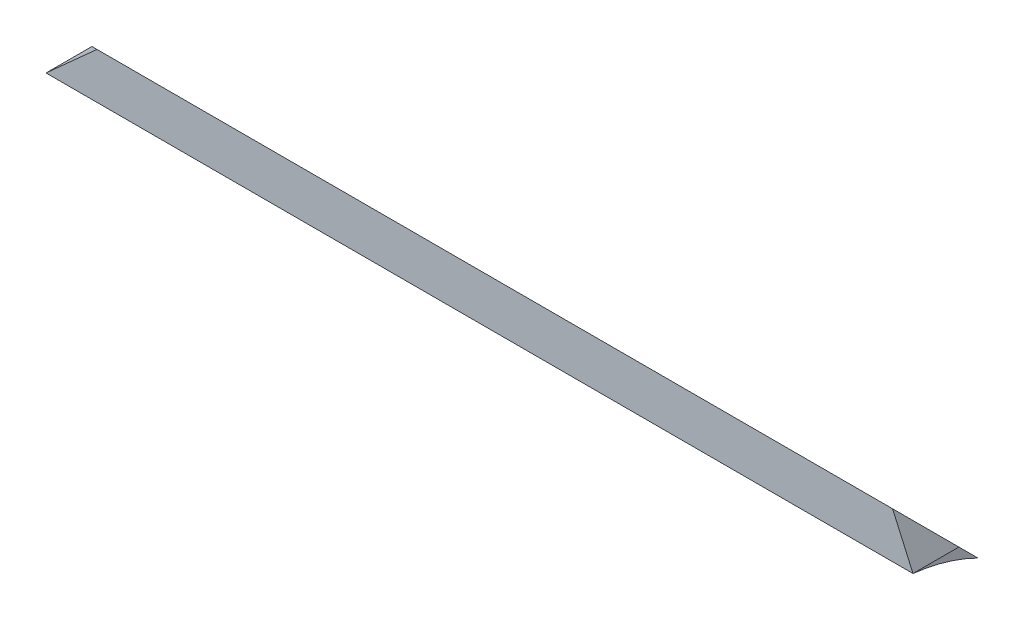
SolidWorks part; units mm, degrees
ref_plane "Front Plane" through (0, 0, 0) normal (0, 0, 1) x (1, 0, 0)
ref_plane "Top Plane" through (0, 0, 0) normal (0, 1, 0) x (1, 0, 0)
ref_plane "Right Plane" through (0, 0, 0) normal (1, 0, 0) x (0, 0, -1)
sketch "Sketch1" plane through (0, 0, 0) normal (0, 1, 0) x (1, 0, 0)
  line L1 (0, 0) -> (127, 0)
  line L2 (0, 0) -> (0, 12.7)
  line L3 (0, 12.7) -> (127, 12.7)
  line L4 (127, 0) -> (127, 12.7)
  dimension "D1" = 127
  dimension "D2" = 12.7
extrude "Extrude1" add sketch "Sketch1" along normal blind 12.7
sketch "Sketch2" plane through (127, 0, 0) normal (1, 0, 0) x (0, 0, -1)
  line L0 (0, 12.7) -> (12.7, 0)
  line L1 (0, 12.7) -> (12.7, 12.7)
  line L2 (12.7, 12.7) -> (12.7, 0)
extrude "Cut-Extrude1" cut sketch "Sketch2" against normal through all
sketch "Sketch3" plane through (127, 0, 0) normal (1, 0, 0) x (0, 0, -1)
  line L0 (0, 2.9773) -> (0, 22.1081)
  line L1 (0, 22.1081) -> (3.175, 22.1081)
  line L2 (3.175, 22.1081) -> (3.175, 2.8004)
  arc A0 (0, 2.9773) -> (3.175, 2.8004) centre (0, -25.5977) ccw
  dimension "D1" = 28.575
  dimension "D2" = 3.175
extrude "Cut-Extrude2" cut sketch "Sketch3" against normal through all
sketch "Sketch5" plane through (0, 0, 0) normal (0, 0, 1) x (1, 0, 0)
  line L0 (127, 0) -> (127, 2.8004)
  line L1 (127, 2.8004) -> (101.6, 59.9504)
  line L2 (101.6, 59.9504) -> (63.5, 59.9504)
  line L3 (63.5, 59.9504) -> (0, 2.8004)
  line L4 (127, 0) -> (0, 0)
  line L5 (0, 2.8004) -> (0, 0)
  line L6 (0, 2.8004) -> (127, 2.8004) construction
  dimension "D1" = 25.4
  dimension "D2" = 63.5
  dimension "D3" = 57.15
extrude "Cut-Extrude7" cut sketch "Sketch5" against normal through all flip side to cut
